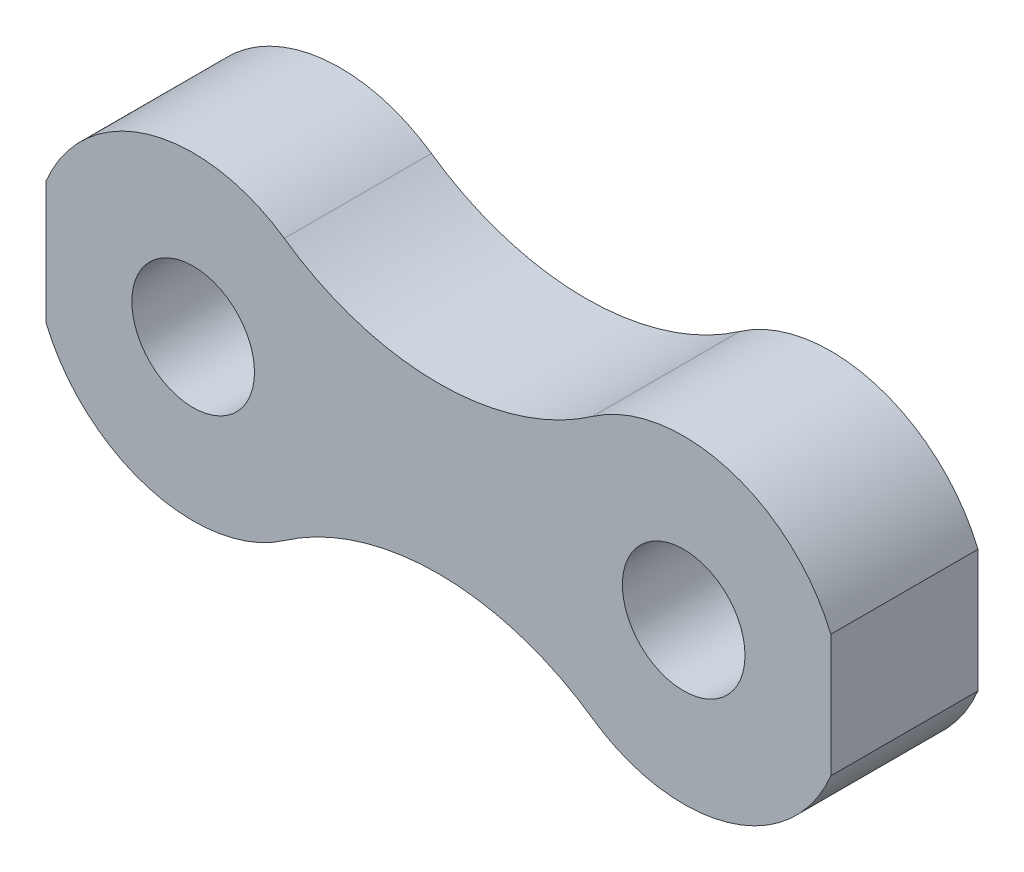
SolidWorks part; units mm, degrees
ref_plane "Ebene vorne" through (0, 0, 0) normal (0, 0, 1) x (1, 0, 0)
ref_plane "Ebene oben" through (0, 0, 0) normal (0, 1, 0) x (1, 0, 0)
ref_plane "Ebene rechts" through (0, 0, 0) normal (1, 0, 0) x (0, 0, -1)
sketch "Skizze1" plane through (0, 0, 0) normal (0, 0, 1) x (1, 0, 0)
  line L0 (0, 0) -> (20, 0) construction
  line L1 (10, -12.0374) -> (10, 20.3503) construction
  circle A0 centre (0, 0) radius 2.5
  circle A1 centre (20, 0) radius 2.5
  arc A2 (3.7143, 5.3342) -> (3.7143, -5.3342) centre (0, 0) ccw
  arc A3 (16.2857, -5.3342) -> (16.2857, 5.3342) centre (20, 0) ccw
  arc A4 (16.2857, 5.3342) -> (3.7143, 5.3342) centre (10, 14.3614) cw
  arc A5 (16.2857, -5.3342) -> (3.7143, -5.3342) centre (10, -14.3614) ccw
  circle A6 centre (0, 0) radius 6.5 construction
  circle A7 centre (20, 0) radius 6.5 construction
  dimension "D2" = 5
  dimension "D3" = 20
  dimension "D4" = 11
  dimension "D1" = 4
extrude "Linear austragen2" add sketch "Skizze1" along normal mid plane 6
sketch "Skizze2" plane through (0, 0, 3) normal (0, 0, 1) x (1, 0, 0)
  line L0 (10, -5.8734) -> (10, 7.6917) construction
  line L1 (-6, 10.5178) -> (26, 10.5178)
  line L2 (-6, 10.5178) -> (-6, -9.5069)
  line L3 (-6, -9.5069) -> (26, -9.5069)
  line L4 (26, 10.5178) -> (26, -9.5069)
  line L5 (10, -12.0374) -> (10, 20.3503) construction
  dimension "D1" = 32
extrude "Schnitt-Linear austragen1" cut sketch "Skizze2" against normal through all flip side to cut
equation "\"LÄNGE\"=0"
equation "\"BREITE\"=0"
equation "\"HÖHE\"=0"
equation "\"DURCHMESSER\"=0"
equation "\"Stückzahl\"= 1"
